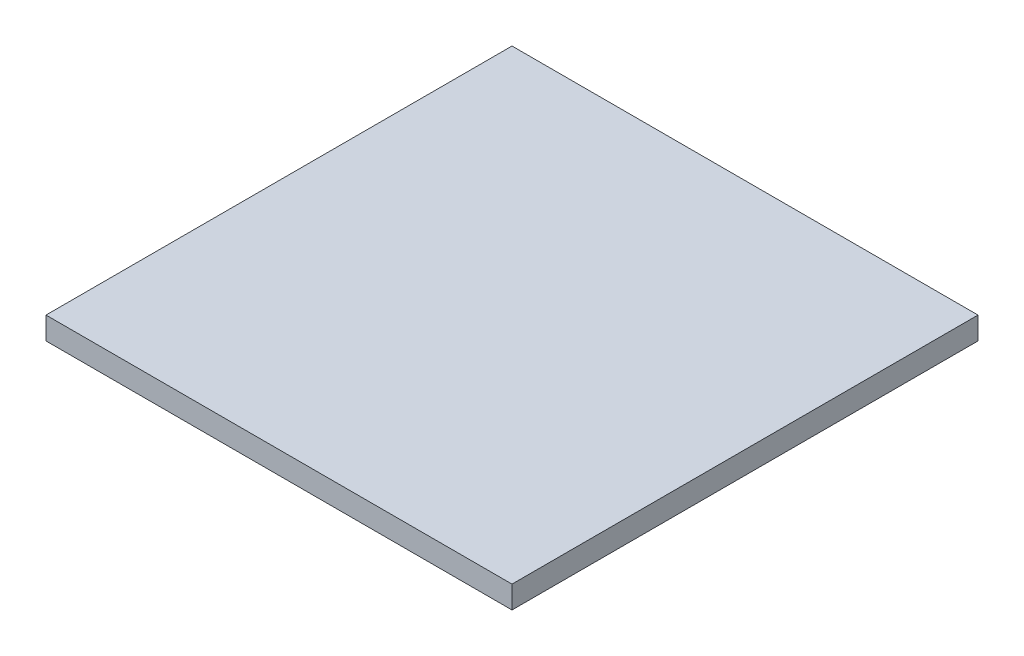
SolidWorks part; units mm, degrees
ref_plane "Front Plane" through (0, 0, 0) normal (0, 0, 1) x (1, 0, 0)
ref_plane "Top Plane" through (0, 0, 0) normal (0, 1, 0) x (1, 0, 0)
ref_plane "Right Plane" through (0, 0, 0) normal (1, 0, 0) x (0, 0, -1)
sketch "Sketch1" plane through (0, 0, 0) normal (0, 1, 0) x (1, 0, 0)
  line L1 (-13.5, -13.5) -> (13.5, -13.5)
  line L2 (-13.5, -13.5) -> (-13.5, 13.5)
  line L3 (-13.5, 13.5) -> (13.5, 13.5)
  line L4 (13.5, -13.5) -> (13.5, 13.5)
  line L5 (-13.5, -13.5) -> (13.5, 13.5) construction
  line L6 (-13.5, 13.5) -> (13.5, -13.5) construction
  point P0 (0, 0)
  dimension "D1" = 27
extrude "Boss-Extrude1" add sketch "Sketch1" along normal blind 1.3 contours L3 L4 L1 L2
